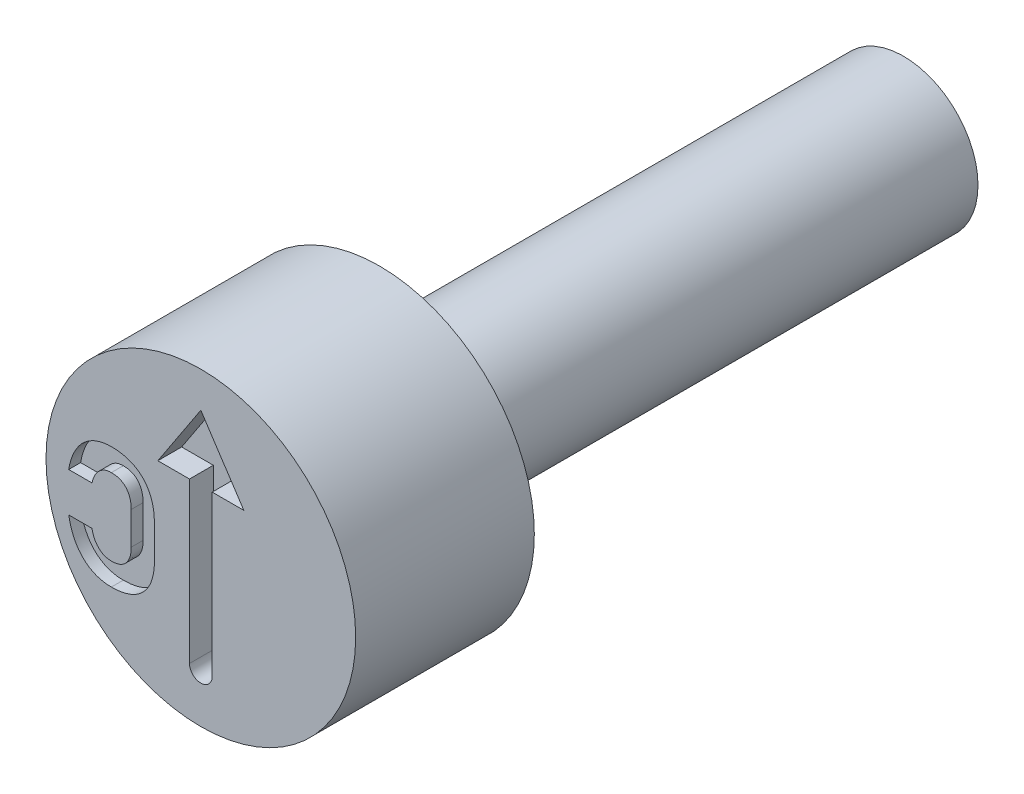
SolidWorks part; units mm, degrees
ref_plane "Front Plane" through (0, 0, 0) normal (0, 0, 1) x (1, 0, 0)
ref_plane "Top Plane" through (0, 0, 0) normal (0, 1, 0) x (1, 0, 0)
ref_plane "Right Plane" through (0, 0, 0) normal (1, 0, 0) x (0, 0, -1)
sketch "Sketch2" plane through (0, 0, 0) normal (1, 0, 0) x (0, 0, -1)
  line L0 (0.4039, 0) -> (50000.4039, 0) construction
  line L6 (0, 2.6) -> (0, 0)
  line L7 (3, 2.6) -> (0, 2.6)
  line L8 (3, 1.25) -> (3, 2.6)
  line L9 (11.8, 1.25) -> (3, 1.25)
  line L10 (11.8, 0) -> (11.8, 1.25)
  line L11 (0, 0) -> (11.8, 0)
  dimension "D1" = 5.2
  dimension "D2" = 2.5
  dimension "D3" = 11.8
  dimension "D4" = 3
revolve "Revolve1" add sketch "Sketch2" angle 360 about L0
sketch "Sketch3" plane through (0, 0, 0) normal (0, 0, 1) x (1, 0, 0)
  line L0 (0, 0) -> (0, 100000) construction
  line L1 (0.1905, 0.9064) -> (0.1905, -1.7762)
  line L2 (0.7219, 0.9064) -> (0.1905, 0.9064)
  line L3 (0, 2.0021) -> (0.7219, 0.9064)
  line L15 (0, 2.0021) -> (-0.7219, 0.9064)
  line L16 (-0.7219, 0.9064) -> (-0.1905, 0.9064)
  line L17 (-0.1905, 0.9064) -> (-0.1905, -1.7762)
  arc A2 (-0.1905, -1.7762) -> (0.1905, -1.7762) centre (0, -1.7762) ccw
extrude "Cut-Extrude4" cut sketch "Sketch3" against normal blind 0.4
sketch "Sketch4" plane through (0, 0, 0) normal (0, 0, 1) x (1, 0, 0)
  text T0 "C" font "Bahnschrift" height 2
  dimension "D1" = 1.3
  dimension "D2" = 0.6
extrude "Cut-Extrude5" cut sketch "Sketch4" against normal blind 0.2
